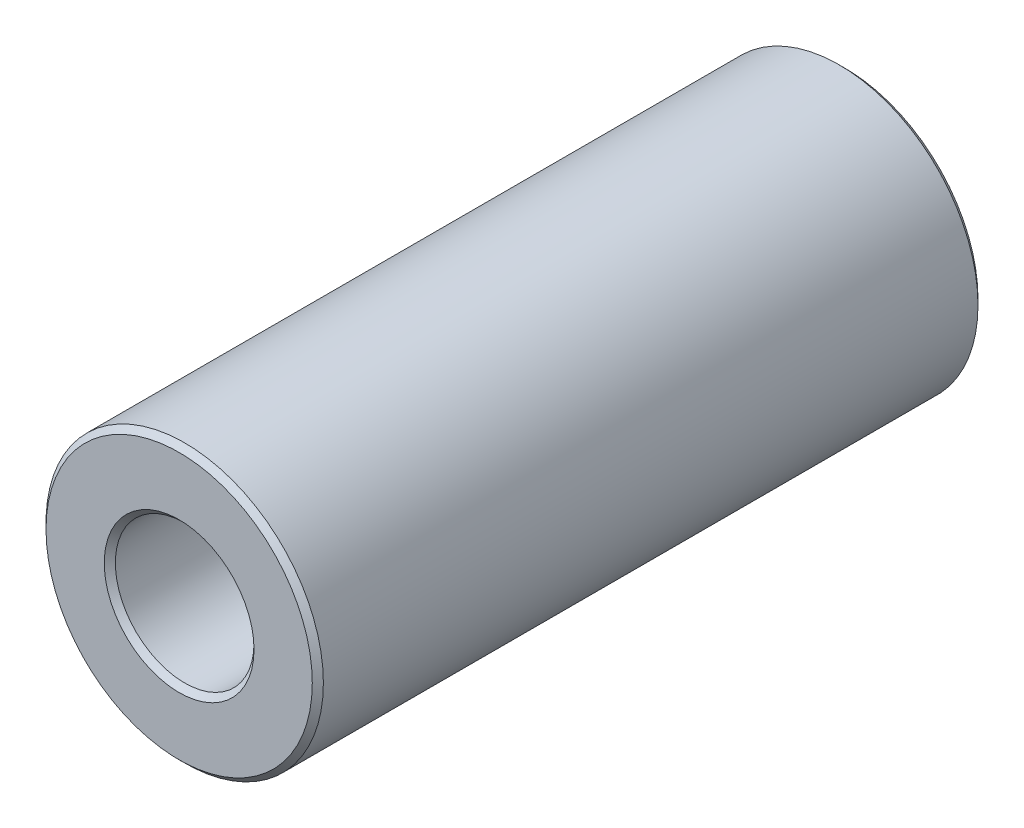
SolidWorks part; units mm, degrees
ref_plane "Front Plane" through (0, 0, 0) normal (0, 0, 1) x (1, 0, 0)
ref_plane "Top Plane" through (0, 0, 0) normal (0, 1, 0) x (1, 0, 0)
ref_plane "Right Plane" through (0, 0, 0) normal (1, 0, 0) x (0, 0, -1)
sketch "Sketch1" plane through (0, 0, 0) normal (0, 0, 1) x (1, 0, 0)
  circle A0 centre (0, 0) radius 2.5
  circle A1 centre (0, 0) radius 1.25
  dimension "D1" = 5
  dimension "D2" = 2.5
extrude "Boss-Extrude2" add sketch "Sketch1" along normal mid plane 12
chamfer "Chamfer3" distance 0.1 angle 45 4 edges at (2.5, 0, 6) (2.5, 0, -6) (1.25, 0, -6) (1.25, 0, 6)
